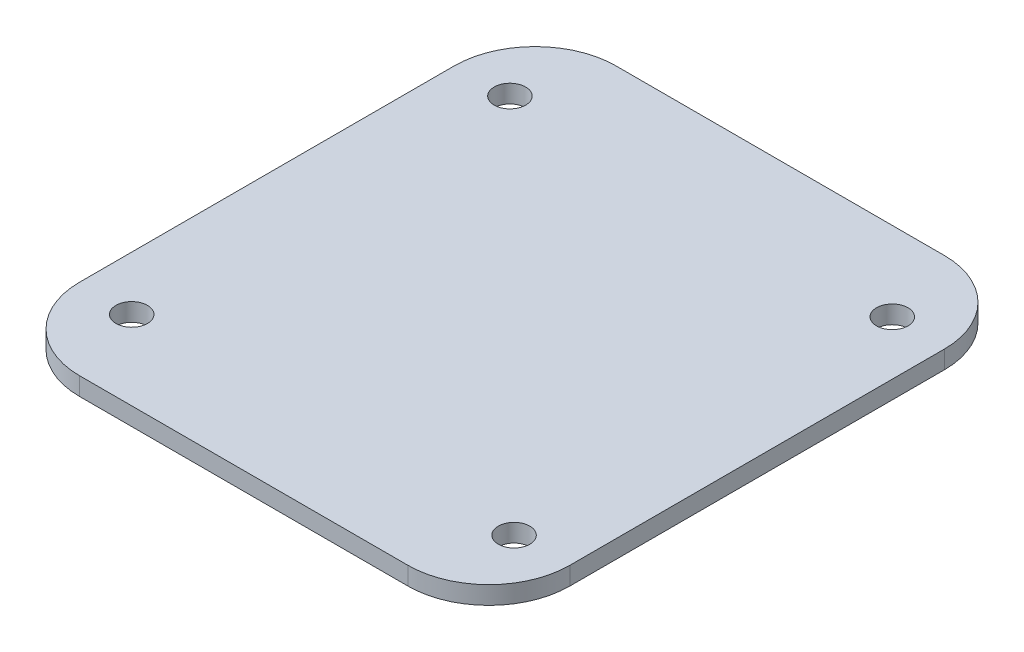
SolidWorks part; units mm, degrees
ref_plane "Front Plane" through (0, 0, 0) normal (0, 0, 1) x (1, 0, 0)
ref_plane "Top Plane" through (0, 0, 0) normal (0, 1, 0) x (1, 0, 0)
ref_plane "Right Plane" through (0, 0, 0) normal (1, 0, 0) x (0, 0, -1)
sketch "sk w14x665" plane through (0, 0, 0) normal (0, 1, 0) x (1, 0, 0)
  line L0 (-224.155, 274.828) -> (224.155, -274.828) construction
  point P1 (35.941, 0)
  line B0 (-224.155, -274.828) -> (-224.155, -160.02)
  line B1 (-224.155, -160.02) -> (-51.181, -160.02)
  line B2 (-35.941, -144.78) -> (-35.941, 144.78)
  line B3 (-51.181, 160.02) -> (-224.155, 160.02)
  line B4 (-224.155, 160.02) -> (-224.155, 274.828)
  line B5 (-224.155, 274.828) -> (224.155, 274.828)
  line B6 (224.155, 274.828) -> (224.155, 160.02)
  line B7 (224.155, 160.02) -> (51.181, 160.02)
  line B8 (35.941, 144.78) -> (35.941, -144.78)
  line B9 (51.181, -160.02) -> (224.155, -160.02)
  line B10 (224.155, -160.02) -> (224.155, -274.828)
  line B11 (224.155, -274.828) -> (-224.155, -274.828)
  line B12 (0, -346.9641) -> (0, 274.828) construction
  arc B13 (-51.181, -160.02) -> (-35.941, -144.78) centre (-51.181, -144.78) ccw
  arc B14 (-35.941, 144.78) -> (-51.181, 160.02) centre (-51.181, 144.78) ccw
  arc B15 (51.181, 160.02) -> (35.941, 144.78) centre (51.181, 144.78) ccw
  arc B16 (35.941, -144.78) -> (51.181, -160.02) centre (51.181, -144.78) ccw
sketch_block_instance "W14x665-1"
sketch_block "W14x665" parameters "D6"=15.24, "D1"=71.882, "D2"=448.31, "D3"=549.656, "D4"=114.808, "D5"=114.808, "D7"=35.941
ref_plane "midplane" through (0, 44.45, 0) normal (0, 1, 0) x (1, 0, 0)
sketch "clearance" plane through (0, 44.45, 0) normal (0, 1, 0) x (1, 0, 0)
  line L6 (-224.155, 274.828) -> (224.155, 274.828) construction
  line L7 (-224.155, 160.02) -> (-224.155, 274.828) construction
  line L8 (-51.181, 160.02) -> (-224.155, 160.02) construction
  line L9 (-35.941, -144.78) -> (-35.941, 144.78) construction
  line L10 (35.941, 144.78) -> (35.941, -144.78) construction
  line L12 (224.155, 274.828) -> (224.155, 160.02) construction
  line L13 (51.181, -160.02) -> (224.155, -160.02) construction
  line L14 (224.155, -274.828) -> (-224.155, -274.828) construction
  line L68 (-229.235, 271.5441) -> (-220.8711, 279.908)
  line L69 (-220.8711, 279.908) -> (220.8711, 279.908)
  line L70 (220.8711, 279.908) -> (229.235, 271.5441)
  line L71 (229.235, 271.5441) -> (229.235, 163.3039)
  line L72 (229.235, 163.3039) -> (220.8711, 154.94)
  line L73 (220.8711, 154.94) -> (50.0013, 154.94)
  line L74 (50.0013, 154.94) -> (41.021, 145.9597)
  line L75 (41.021, 145.9597) -> (41.021, -145.9597)
  line L76 (41.021, -145.9597) -> (50.0013, -154.94)
  line L77 (50.0013, -154.94) -> (220.8711, -154.94)
  line L78 (220.8711, -154.94) -> (229.235, -163.3039)
  line L79 (229.235, -163.3039) -> (229.235, -271.5441)
  line L80 (229.235, -271.5441) -> (220.8711, -279.908)
  line L81 (220.8711, -279.908) -> (-220.8711, -279.908)
  line L82 (-220.8711, -279.908) -> (-229.235, -271.5441)
  line L83 (-229.235, -271.5441) -> (-229.235, -163.3039)
  line L84 (-229.235, -163.3039) -> (-220.8711, -154.94)
  line L85 (-220.8711, -154.94) -> (-50.0013, -154.94)
  line L86 (-50.0013, -154.94) -> (-41.021, -145.9597)
  line L87 (-41.021, -145.9597) -> (-41.021, 145.9597)
  line L88 (-41.021, 145.9597) -> (-50.0013, 154.94)
  line L89 (-50.0013, 154.94) -> (-220.8711, 154.94)
  line L90 (-220.8711, 154.94) -> (-229.235, 163.3039)
  line L91 (-229.235, 163.3039) -> (-229.235, 271.5441)
  dimension "D3" = 1.27
  dimension "D4" = 45
  dimension "D5" = 45
  dimension "D6" = 1.27
  dimension "D7" = 5.08
  dimension "D8" = 1.27
  dimension "D9" = 5.08
  dimension "D10" = 5.08
  dimension "D11" = 5.08
  dimension "D12" = 5.08
  dimension "D13" = 1.27
  dimension "D14" = 5.08
  dimension "D15" = 1.27
  dimension "D16" = 5.08
  dimension "D17" = 12.7
  dimension "D18" = 1.27
  dimension "D19" = 5.08
  dimension "D20" = 12.7
  dimension "D21" = 12.7
  dimension "D22" = 12.7
  dimension "D23" = 1.27
  dimension "D24" = 1.27
sketch "bolt plate boundary" plane through (0, 0, 0) normal (0, 1, 0) x (1, 0, 0)
  line L7 (224.155, -274.828) -> (241.3488, -295.9087)
  line L8 (-220.8711, 279.908) -> (220.8711, 279.908) construction
  line L9 (-224.155, 274.828) -> (224.155, -274.828) construction
  line L10 (-41.021, -145.9597) -> (-41.021, 145.9597) construction
  line L11 (-224.155, 274.828) -> (-241.3488, 295.9087)
  line L12 (41.021, 145.9597) -> (41.021, -145.9597) construction
  line L15 (220.8711, -279.908) -> (-220.8711, -279.908) construction
  point P15 (0, -305.5874)
  point P16 (-66.7004, 0)
  point P17 (-308.3103, 362.8701)
  point P18 (-308.3103, 362.8701)
  point P19 (66.7004, 0)
  line B0 (-308.3103, 362.8701) -> (-350.8966, 289.1084) construction
  line B1 (-268.8989, 294.6076) -> (-229.4875, 362.8701)
  line B2 (-229.4875, 362.8701) -> (-268.8989, 431.1326)
  line B3 (-268.8989, 431.1326) -> (-347.7216, 431.1326)
  line B4 (-347.7216, 431.1326) -> (-387.133, 362.8701)
  line B5 (-387.133, 362.8701) -> (-347.7216, 294.6076)
  line B6 (-347.7216, 294.6076) -> (-268.8989, 294.6076)
  line B7 (-375.2717, 429.8316) -> (-241.3488, 295.9087) construction
  line B8 (-241.3488, 429.8316) -> (-375.2717, 295.9087) construction
  line B9 (-308.3103, 362.8701) -> (-282.9103, 362.8701) construction
  circle B10 centre (-308.3103, 362.8701) radius 44.45
  circle B11 centre (-308.3103, 362.8701) radius 68.2625 construction
  circle B12 centre (-308.3103, 362.8701) radius 85.1727
  circle B13 centre (-308.3103, 362.8701) radius 94.6977 construction
  line B14 (308.3103, -362.8701) -> (265.7239, -436.6319) construction
  line B15 (347.7216, -431.1326) -> (387.133, -362.8701)
  line B16 (387.133, -362.8701) -> (347.7216, -294.6076)
  line B17 (347.7216, -294.6076) -> (268.8989, -294.6076)
  line B18 (268.8989, -294.6076) -> (229.4875, -362.8701)
  line B19 (229.4875, -362.8701) -> (268.8989, -431.1326)
  line B20 (268.8989, -431.1326) -> (347.7216, -431.1326)
  line B21 (241.3488, -295.9087) -> (375.2717, -429.8316) construction
  line B22 (375.2717, -295.9087) -> (241.3488, -429.8316) construction
  line B23 (308.3103, -362.8701) -> (333.7103, -362.8701) construction
  circle B24 centre (308.3103, -362.8701) radius 44.45
  circle B25 centre (308.3103, -362.8701) radius 68.2625 construction
  circle B26 centre (308.3103, -362.8701) radius 85.1727
  circle B27 centre (308.3103, -362.8701) radius 94.6977 construction
  line B28 (39.4114, 468.5476) -> (-39.4114, 468.5476)
  line B29 (-78.8227, 400.2851) -> (-39.4114, 332.0226)
  line B30 (-39.4114, 332.0226) -> (39.4114, 332.0226)
  line B31 (-66.9614, 467.2466) -> (66.9614, 333.3237) construction
  line B32 (66.9614, 467.2466) -> (-66.9614, 333.3237) construction
  circle B33 centre (0, 400.2851) radius 44.45
  circle B34 centre (0, 400.2851) radius 68.2625 construction
  circle B35 centre (0, 400.2851) radius 85.1727
  circle B36 centre (0, 400.2851) radius 94.6977 construction
  line B37 (39.4114, -332.0226) -> (-39.4114, -332.0226)
  line B38 (-39.4114, -332.0226) -> (-78.8227, -400.2851)
  line B39 (-39.4114, -468.5476) -> (39.4114, -468.5476)
  line B40 (0, -400.2851) -> (25.4, -400.2851) construction
  circle B41 centre (0, -400.2851) radius 44.45
  circle B42 centre (0, -400.2851) radius 68.2625 construction
  circle B43 centre (0, -400.2851) radius 85.1727
  circle B44 centre (0, -400.2851) radius 94.6977 construction
  line B45 (-161.3981, 0) -> (-203.9845, -73.7618) construction
  line B46 (-82.5754, 0) -> (-121.9868, 68.2625)
  line B47 (-200.8095, 68.2625) -> (-240.2209, 0)
  line B48 (-240.2209, 0) -> (-200.8095, -68.2625)
  line B49 (-228.3596, 66.9614) -> (-94.4367, -66.9614) construction
  line B50 (-94.4367, 66.9614) -> (-228.3596, -66.9614) construction
  line B51 (-161.3981, 0) -> (-135.9981, 0) construction
  circle B52 centre (-161.3981, 0) radius 44.45
  circle B53 centre (-161.3981, 0) radius 68.2625 construction
  circle B54 centre (-161.3981, 0) radius 85.1727
  circle B55 centre (-161.3981, 0) radius 94.6977 construction
  line B56 (200.8095, -68.2625) -> (240.2209, 0)
  line B57 (240.2209, 0) -> (200.8095, 68.2625)
  line B58 (200.8095, 68.2625) -> (121.9868, 68.2625)
  line B59 (121.9868, 68.2625) -> (82.5754, 0)
  line B60 (82.5754, 0) -> (121.9868, -68.2625)
  line B61 (94.4367, 66.9614) -> (228.3596, -66.9614) construction
  line B62 (161.3981, 0) -> (186.7981, 0) construction
  circle B63 centre (161.3981, 0) radius 44.45
  circle B64 centre (161.3981, 0) radius 68.2625 construction
  circle B65 centre (161.3981, 0) radius 85.1727
  circle B66 centre (161.3981, 0) radius 94.6977 construction
  dimension "D1" = 27.2034
  dimension "D2" = 25.6794
  dimension "D3" = 25.6794
  dimension "D4" = 25.6794
  dimension "D5" = 25.6794
  dimension "D6" = 27.2034
sketch_block_instance "3.5in bolt-3"
sketch_block "3.5in bolt" parameters "D1"=88.9, "D2"=136.525, "D3"=6.35, "D4"=40.7227, "D5"=45, "D6"=9.525
sketch_block_instance "3.5in bolt-4"
sketch_block_instance "3.5in bolt-5"
sketch_block_instance "3.5in bolt-6"
sketch_block_instance "3.5in bolt-7"
sketch_block_instance "3.5in bolt-8"
sketch "Sketch4" plane through (0, 0, 0) normal (0, 1, 0) x (1, 0, 0)
  line L1 (-403.008, 494.9829) -> (403.008, 494.9829)
  line L2 (-403.008, 494.9829) -> (-403.008, -494.9829)
  line L3 (-403.008, -494.9829) -> (403.008, -494.9829)
  line L4 (403.008, 494.9829) -> (403.008, -494.9829)
  circle A1 centre (308.3103, -362.8701) radius 94.6977 construction
  circle A2 centre (0, 400.2851) radius 94.6977 construction
  circle A3 centre (-308.3103, 362.8701) radius 94.6977 construction
  circle A4 centre (0, -400.2851) radius 94.6977 construction
extrude "main plate" add sketch "Sketch4" along normal blind 25.4
sketch "sk bolt holes" plane through (0, 0, 0) normal (0, 1, 0) x (1, 0, 0)
  circle A0 centre (-308.3103, 362.8701) radius 46.0375
  circle A1 centre (0, 400.2851) radius 46.0375
  circle A2 centre (308.3103, 362.8701) radius 46.0375
  circle A3 centre (-308.3103, -362.8701) radius 46.0375
  circle A4 centre (0, -400.2851) radius 46.0375
  circle A5 centre (-161.3981, 0) radius 46.0375
  circle A6 centre (161.3981, 0) radius 46.0375
  circle A7 centre (308.3103, -362.8701) radius 46.0375
  circle A8 centre (-308.3103, 362.8701) radius 44.45 construction
  circle A9 centre (308.3103, -362.8701) radius 44.45 construction
  circle A10 centre (0, 400.2851) radius 44.45 construction
  circle A11 centre (0, -400.2851) radius 44.45 construction
  circle A12 centre (-161.3981, 0) radius 44.45 construction
  circle A13 centre (161.3981, 0) radius 44.45 construction
  dimension "D1" = 92.075
  dimension "D2" = 92.075
  dimension "D3" = 92.075
  dimension "D4" = 92.075
  dimension "D5" = 92.075
  dimension "D6" = 92.075
  dimension "3.56250000in" = 92.075
  dimension "D7" = 92.075
extrude "Cut-Extrude2" [suppressed] cut sketch "sk bolt holes" along normal blind 88.9
fillet "Fillet1" radius 139.7 4 edges at (-403.008, 12.7, -494.9829) (403.008, 12.7, -494.9829) (403.008, 12.7, 494.9829) (-403.008, 12.7, 494.9829)
sketch "Sketch5" [suppressed] plane through (0, 25.4, 0) normal (0, 1, 0) x (1, 0, 0)
  line L1 (-517.2218, 542.3296) -> (487.0923, 542.3296)
  line L2 (-517.2218, 542.3296) -> (-517.2218, -547.3512)
  line L3 (-517.2218, -547.3512) -> (487.0923, -547.3512)
  line L4 (487.0923, 542.3296) -> (487.0923, -547.3512)
extrude "Cut-Extrude3" [suppressed] cut sketch "Sketch5" against normal blind 12.7
sketch "Sketch6" plane through (0, 0, 0) normal (0, 1, 0) x (1, 0, 0)
  point P0 (0, 494.9829)
  point P1 (-403.008, 0)
  line B0 (403.008, 368.6679) -> (403.008, -368.6679)
  line B1 (314.108, -457.5679) -> (108.1676, -457.5679)
  line B2 (63.2663, -476.1666) -> (63.0487, -476.3842)
  line B3 (18.1474, -494.9829) -> (-18.1474, -494.9829)
  line B4 (-63.0487, -476.3842) -> (-63.2663, -476.1666)
  line B5 (-108.1676, -457.5679) -> (-314.108, -457.5679)
  line B6 (-403.008, -368.6679) -> (-403.008, 368.6679)
  line B7 (-314.108, 457.5679) -> (-108.1676, 457.5679)
  line B8 (-63.2663, 476.1666) -> (-63.0487, 476.3842)
  line B9 (-18.1474, 494.9829) -> (18.1474, 494.9829)
  line B10 (63.0487, 476.3842) -> (63.2663, 476.1666)
  line B11 (108.1676, 457.5679) -> (314.108, 457.5679)
  line B12 (-573.1445, 780.0685) -> (706.3295, 780.0685)
  line B13 (-573.1445, 780.0685) -> (-573.1445, -757.0177)
  line B14 (-573.1445, -757.0177) -> (706.3295, -757.0177)
  line B15 (706.3295, 780.0685) -> (706.3295, -757.0177)
  arc B16 (108.1676, -457.5679) -> (63.2663, -476.1666) centre (108.1676, -521.0679) ccw
  arc B17 (63.0487, -476.3842) -> (18.1474, -494.9829) centre (18.1474, -431.4829) cw
  arc B18 (-18.1474, -494.9829) -> (-63.0487, -476.3842) centre (-18.1474, -431.4829) cw
  arc B19 (-63.2663, -476.1666) -> (-108.1676, -457.5679) centre (-108.1676, -521.0679) ccw
  arc B20 (403.008, -368.6679) -> (314.108, -457.5679) centre (314.108, -368.6679) cw
  arc B21 (-314.108, -457.5679) -> (-403.008, -368.6679) centre (-314.108, -368.6679) cw
  arc B22 (403.008, 368.6679) -> (314.108, 457.5679) centre (314.108, 368.6679) ccw
  arc B23 (-403.008, 368.6679) -> (-314.108, 457.5679) centre (-314.108, 368.6679) cw
  arc B24 (63.2663, 476.1666) -> (108.1676, 457.5679) centre (108.1676, 521.0679) ccw
  arc B25 (18.1474, 494.9829) -> (63.0487, 476.3842) centre (18.1474, 431.4829) cw
  arc B26 (-63.0487, 476.3842) -> (-18.1474, 494.9829) centre (-18.1474, 431.4829) cw
  arc B27 (-108.1676, 457.5679) -> (-63.2663, 476.1666) centre (-108.1676, 521.0679) ccw
sketch_block_instance "Block1-1"
sketch_block "Block1"
extrude "Edge cut" cut sketch "Sketch6" along normal blind 25.4
sketch "Sketch7" plane through (0, 0, 0) normal (0, 1, 0) x (1, 0, 0)
  line L13 (-506.5225, 548.6406) -> (494.7508, 548.6406)
  line L14 (-506.5225, 548.6406) -> (-506.5225, -578.858)
  line L15 (-506.5225, -578.858) -> (494.7508, -578.858)
  line L16 (494.7508, 548.6406) -> (494.7508, -578.858)
  line L24 (-314.108, -444.8679) -> (-108.1676, -444.8679)
  line L25 (-54.286, -467.1863) -> (-54.0685, -467.4039)
  line L26 (-18.1474, -482.2829) -> (18.1474, -482.2829)
  line L27 (54.0685, -467.4039) -> (54.286, -467.1863)
  line L28 (108.1676, -444.8679) -> (314.108, -444.8679)
  line L29 (390.308, -355.2829) -> (390.308, 355.2829)
  line L30 (-390.308, 355.2829) -> (-390.308, -355.2829)
  line L31 (314.108, 444.8679) -> (108.1676, 444.8679)
  line L32 (54.286, 467.1863) -> (54.0685, 467.4039)
  line L33 (18.1474, 482.2829) -> (-18.1474, 482.2829)
  line L34 (-54.0685, 467.4039) -> (-54.286, 467.1863)
  line L35 (-108.1676, 444.8679) -> (-314.108, 444.8679)
  line L36 (-314.108, -444.8679) -> (-108.1676, -444.8679)
  line L37 (-54.286, -467.1863) -> (-54.0685, -467.4039)
  line L38 (-18.1474, -482.2829) -> (18.1474, -482.2829)
  line L39 (54.0685, -467.4039) -> (54.286, -467.1863)
  line L40 (108.1676, -444.8679) -> (314.108, -444.8679)
  line L41 (390.308, -355.2829) -> (390.308, 355.2829)
  line L42 (-390.308, 355.2829) -> (-390.308, -355.2829)
  line L43 (314.108, 444.8679) -> (108.1676, 444.8679)
  line L44 (54.286, 467.1863) -> (54.0685, 467.4039)
  line L45 (18.1474, 482.2829) -> (-18.1474, 482.2829)
  line L46 (-54.0685, 467.4039) -> (-54.286, 467.1863)
  line L47 (-108.1676, 444.8679) -> (-314.108, 444.8679)
  arc A32 (314.108, -444.8679) -> (377.3411, -411.1887) centre (314.108, -368.6679) ccw
  arc A33 (-377.3411, -411.1887) -> (-314.108, -444.8679) centre (-314.108, -368.6679) ccw
  arc A34 (-54.286, -467.1863) -> (-108.1676, -444.8679) centre (-108.1676, -521.0679) ccw
  arc A35 (-54.0685, -467.4039) -> (-18.1474, -482.2829) centre (-18.1474, -431.4829) ccw
  arc A36 (18.1474, -482.2829) -> (54.0685, -467.4039) centre (18.1474, -431.4829) ccw
  arc A37 (108.1676, -444.8679) -> (54.286, -467.1863) centre (108.1676, -521.0679) ccw
  arc A38 (390.308, 355.2829) -> (377.3411, 411.1887) centre (263.308, 355.2829) ccw
  arc A39 (377.3411, -411.1887) -> (390.308, -355.2829) centre (263.308, -355.2829) ccw
  arc A40 (-390.308, -355.2829) -> (-377.3411, -411.1887) centre (-263.308, -355.2829) ccw
  arc A41 (-377.3411, 411.1887) -> (-390.308, 355.2829) centre (-263.308, 355.2829) ccw
  arc A42 (-314.108, 444.8679) -> (-377.3411, 411.1887) centre (-314.108, 368.6679) ccw
  arc A43 (377.3411, 411.1887) -> (314.108, 444.8679) centre (314.108, 368.6679) ccw
  arc A44 (54.286, 467.1863) -> (108.1676, 444.8679) centre (108.1676, 521.0679) ccw
  arc A45 (54.0685, 467.4039) -> (18.1474, 482.2829) centre (18.1474, 431.4829) ccw
  arc A46 (-18.1474, 482.2829) -> (-54.0685, 467.4039) centre (-18.1474, 431.4829) ccw
  arc A47 (-108.1676, 444.8679) -> (-54.286, 467.1863) centre (-108.1676, 521.0679) ccw
  arc A48 (314.108, -444.8679) -> (377.3411, -411.1887) centre (314.108, -368.6679) ccw
  arc A49 (-377.3411, -411.1887) -> (-314.108, -444.8679) centre (-314.108, -368.6679) ccw
  arc A50 (-54.286, -467.1863) -> (-108.1676, -444.8679) centre (-108.1676, -521.0679) ccw
  arc A51 (-54.0685, -467.4039) -> (-18.1474, -482.2829) centre (-18.1474, -431.4829) ccw
  arc A52 (18.1474, -482.2829) -> (54.0685, -467.4039) centre (18.1474, -431.4829) ccw
  arc A53 (108.1676, -444.8679) -> (54.286, -467.1863) centre (108.1676, -521.0679) ccw
  arc A54 (390.308, 355.2829) -> (377.3411, 411.1887) centre (263.308, 355.2829) ccw
  arc A55 (377.3411, -411.1887) -> (390.308, -355.2829) centre (263.308, -355.2829) ccw
  arc A56 (-390.308, -355.2829) -> (-377.3411, -411.1887) centre (-263.308, -355.2829) ccw
  arc A57 (-377.3411, 411.1887) -> (-390.308, 355.2829) centre (-263.308, 355.2829) ccw
  arc A58 (-314.108, 444.8679) -> (-377.3411, 411.1887) centre (-314.108, 368.6679) ccw
  arc A59 (377.3411, 411.1887) -> (314.108, 444.8679) centre (314.108, 368.6679) ccw
  arc A60 (54.286, 467.1863) -> (108.1676, 444.8679) centre (108.1676, 521.0679) ccw
  arc A61 (54.0685, 467.4039) -> (18.1474, 482.2829) centre (18.1474, 431.4829) ccw
  arc A62 (-18.1474, 482.2829) -> (-54.0685, 467.4039) centre (-18.1474, 431.4829) ccw
  arc A63 (-108.1676, 444.8679) -> (-54.286, 467.1863) centre (-108.1676, 521.0679) ccw
  dimension "D1" = 12.7
extrude "Cut-Extrude4" cut sketch "Sketch7" along normal blind 25.4
sketch "Sketch8" plane through (0, 0, 0) normal (0, 1, 0) x (1, 0, 0)
  circle A0 centre (-308.3103, 362.8701) radius 46.0375 construction
  circle A1 centre (0, 400.2851) radius 46.0375 construction
  circle A2 centre (308.3103, 362.8701) radius 46.0375 construction
  circle A3 centre (-161.3981, 0) radius 46.0375 construction
  circle A4 centre (161.3981, 0) radius 46.0375 construction
  circle A5 centre (-308.3103, -362.8701) radius 46.0375 construction
  circle A6 centre (0, -400.2851) radius 46.0375 construction
  circle A7 centre (308.3103, -362.8701) radius 46.0375 construction
sketch_block_instance "Block4-1"
sketch_block "Block4" parameters "D1"=71.4375, "D2"=93.98
sketch_block_instance "Block4-2"
sketch_block_instance "Block4-3"
sketch_block_instance "Block4-4"
sketch_block_instance "Block4-5"
sketch_block_instance "Block4-6"
sketch_block_instance "Block4-7"
sketch_block_instance "Block4-8"
extrude "Boss-Extrude1" [suppressed] add sketch "Sketch8" along normal blind 25.4
sketch "Sketch9" [suppressed] plane through (0, 0, 0) normal (0, 1, 0) x (1, 0, 0)
  line L13 (-545.4331, 590.5033) -> (520.9998, 590.5033)
  line L14 (-545.4331, 590.5033) -> (-545.4331, -615.1185)
  line L15 (-545.4331, -615.1185) -> (520.9998, -615.1185)
  line L16 (520.9998, 590.5033) -> (520.9998, -615.1185)
  line L24 (-314.108, -444.8679) -> (-108.1676, -444.8679)
  line L25 (-54.286, -467.1863) -> (-54.0685, -467.4039)
  line L26 (-18.1474, -482.2829) -> (18.1474, -482.2829)
  line L27 (54.0685, -467.4039) -> (54.286, -467.1863)
  line L28 (108.1676, -444.8679) -> (314.108, -444.8679)
  line L29 (390.308, -355.2829) -> (390.308, 355.2829)
  line L30 (-390.308, 355.2829) -> (-390.308, -355.2829)
  line L31 (314.108, 444.8679) -> (108.1676, 444.8679)
  line L32 (54.286, 467.1863) -> (54.0685, 467.4039)
  line L33 (18.1474, 482.2829) -> (-18.1474, 482.2829)
  line L34 (-54.0685, 467.4039) -> (-54.286, 467.1863)
  line L35 (-108.1676, 444.8679) -> (-314.108, 444.8679)
  line L36 (-314.108, -444.8679) -> (-108.1676, -444.8679)
  line L37 (-54.286, -467.1863) -> (-54.0685, -467.4039)
  line L38 (-18.1474, -482.2829) -> (18.1474, -482.2829)
  line L39 (54.0685, -467.4039) -> (54.286, -467.1863)
  line L40 (108.1676, -444.8679) -> (314.108, -444.8679)
  line L41 (390.308, -355.2829) -> (390.308, 355.2829)
  line L42 (-390.308, 355.2829) -> (-390.308, -355.2829)
  line L43 (314.108, 444.8679) -> (108.1676, 444.8679)
  line L44 (54.286, 467.1863) -> (54.0685, 467.4039)
  line L45 (18.1474, 482.2829) -> (-18.1474, 482.2829)
  line L46 (-54.0685, 467.4039) -> (-54.286, 467.1863)
  line L47 (-108.1676, 444.8679) -> (-314.108, 444.8679)
  arc A32 (-377.3411, -411.1887) -> (-314.108, -444.8679) centre (-314.108, -368.6679) ccw
  arc A33 (-54.286, -467.1863) -> (-108.1676, -444.8679) centre (-108.1676, -521.0679) ccw
  arc A34 (-54.0685, -467.4039) -> (-18.1474, -482.2829) centre (-18.1474, -431.4829) ccw
  arc A35 (18.1474, -482.2829) -> (54.0685, -467.4039) centre (18.1474, -431.4829) ccw
  arc A36 (108.1676, -444.8679) -> (54.286, -467.1863) centre (108.1676, -521.0679) ccw
  arc A37 (314.108, -444.8679) -> (377.3411, -411.1887) centre (314.108, -368.6679) ccw
  arc A38 (390.308, 355.2829) -> (377.3411, 411.1887) centre (263.308, 355.2829) ccw
  arc A39 (377.3411, -411.1887) -> (390.308, -355.2829) centre (263.308, -355.2829) ccw
  arc A40 (-390.308, -355.2829) -> (-377.3411, -411.1887) centre (-263.308, -355.2829) ccw
  arc A41 (-377.3411, 411.1887) -> (-390.308, 355.2829) centre (-263.308, 355.2829) ccw
  arc A42 (377.3411, 411.1887) -> (314.108, 444.8679) centre (314.108, 368.6679) ccw
  arc A43 (54.286, 467.1863) -> (108.1676, 444.8679) centre (108.1676, 521.0679) ccw
  arc A44 (54.0685, 467.4039) -> (18.1474, 482.2829) centre (18.1474, 431.4829) ccw
  arc A45 (-18.1474, 482.2829) -> (-54.0685, 467.4039) centre (-18.1474, 431.4829) ccw
  arc A46 (-108.1676, 444.8679) -> (-54.286, 467.1863) centre (-108.1676, 521.0679) ccw
  arc A47 (-314.108, 444.8679) -> (-377.3411, 411.1887) centre (-314.108, 368.6679) ccw
  arc A48 (-377.3411, -411.1887) -> (-314.108, -444.8679) centre (-314.108, -368.6679) ccw
  arc A49 (-54.286, -467.1863) -> (-108.1676, -444.8679) centre (-108.1676, -521.0679) ccw
  arc A50 (-54.0685, -467.4039) -> (-18.1474, -482.2829) centre (-18.1474, -431.4829) ccw
  arc A51 (18.1474, -482.2829) -> (54.0685, -467.4039) centre (18.1474, -431.4829) ccw
  arc A52 (108.1676, -444.8679) -> (54.286, -467.1863) centre (108.1676, -521.0679) ccw
  arc A53 (314.108, -444.8679) -> (377.3411, -411.1887) centre (314.108, -368.6679) ccw
  arc A54 (390.308, 355.2829) -> (377.3411, 411.1887) centre (263.308, 355.2829) ccw
  arc A55 (377.3411, -411.1887) -> (390.308, -355.2829) centre (263.308, -355.2829) ccw
  arc A56 (-390.308, -355.2829) -> (-377.3411, -411.1887) centre (-263.308, -355.2829) ccw
  arc A57 (-377.3411, 411.1887) -> (-390.308, 355.2829) centre (-263.308, 355.2829) ccw
  arc A58 (377.3411, 411.1887) -> (314.108, 444.8679) centre (314.108, 368.6679) ccw
  arc A59 (54.286, 467.1863) -> (108.1676, 444.8679) centre (108.1676, 521.0679) ccw
  arc A60 (54.0685, 467.4039) -> (18.1474, 482.2829) centre (18.1474, 431.4829) ccw
  arc A61 (-18.1474, 482.2829) -> (-54.0685, 467.4039) centre (-18.1474, 431.4829) ccw
  arc A62 (-108.1676, 444.8679) -> (-54.286, 467.1863) centre (-108.1676, 521.0679) ccw
  arc A63 (-314.108, 444.8679) -> (-377.3411, 411.1887) centre (-314.108, 368.6679) ccw
  dimension "D1" = 12.7
extrude "Cut-Extrude5" [suppressed] cut sketch "Sketch9" along normal blind 25.4
sketch "Sketch10" plane through (0, 0, 0) normal (0, 1, 0) x (1, 0, 0)
  circle A0 centre (-308.3103, 362.8701) radius 46.0375 construction
  circle A1 centre (0, 400.2851) radius 46.0375 construction
  circle A2 centre (308.3103, 362.8701) radius 46.0375 construction
  circle A3 centre (-161.3981, 0) radius 46.0375 construction
  circle A4 centre (161.3981, 0) radius 46.0375 construction
  circle A5 centre (-308.3103, -362.8701) radius 46.0375 construction
  circle A6 centre (0, -400.2851) radius 46.0375 construction
  circle A7 centre (308.3103, -362.8701) radius 46.0375 construction
sketch_block_instance "Block4-9"
sketch_block_instance "Block4-10"
sketch_block_instance "Block4-11"
sketch_block_instance "Block4-12"
sketch_block_instance "Block4-13"
sketch_block_instance "Block4-14"
sketch_block_instance "Block4-15"
sketch_block_instance "Block4-16"
extrude "Boss-Extrude2" [suppressed] add sketch "Sketch10" along normal blind 12.7
sketch "Sketch11" plane through (0, 0, 0) normal (0, 1, 0) x (1, 0, 0)
  line L0 (-284.2097, 311.9592) -> (284.2097, -311.9592) construction
  line L1 (284.2097, -311.9592) -> (-284.2097, -311.9592) construction
  point P2 (0, 0)
  circle B0 centre (-284.2097, 311.9592) radius 32.5438
  circle B1 centre (0, 347.5192) radius 32.5437
  circle B2 centre (284.2097, 311.9592) radius 32.5438
  circle B3 centre (-161.544, 0) radius 32.5437
  circle B4 centre (161.544, 0) radius 32.5438
  circle B5 centre (284.2097, -311.9592) radius 32.5437
  circle B6 centre (0, -347.5192) radius 32.5437
  circle B7 centre (-284.2097, -311.9592) radius 32.5438
sketch_block_instance "Block5-1"
sketch_block "Block5" parameters "D1"=65.0875, "D2"=65.0875, "D3"=65.0875, "D4"=65.0875, "D5"=65.0875, "D6"=65.0875, "D7"=65.0875, "D8"=65.0875
sketch "Sketch12" plane through (0, 0, 0) normal (0, 1, 0) x (1, 0, 0)
  line L1 (-246.1097, 423.7192) -> (246.1097, 423.7192)
  line L2 (-360.4097, 309.4192) -> (-360.4097, -309.4192)
  line L3 (-246.1097, -423.7192) -> (246.1097, -423.7192)
  line L4 (360.4097, 309.4192) -> (360.4097, -309.4192)
  line L5 (-687.2395, 639.3842) -> (677.7027, 639.3842)
  line L6 (-687.2395, 639.3842) -> (-687.2395, -673.7844)
  line L7 (-687.2395, -673.7844) -> (677.7027, -673.7844)
  line L8 (677.7027, 639.3842) -> (677.7027, -673.7844)
  arc A0 (-360.4097, -309.4192) -> (-246.1097, -423.7192) centre (-246.1097, -309.4192) ccw
  arc A1 (246.1097, -423.7192) -> (360.4097, -309.4192) centre (246.1097, -309.4192) ccw
  arc A2 (246.1097, 423.7192) -> (360.4097, 309.4192) centre (246.1097, 309.4192) cw
  arc A3 (-246.1097, 423.7192) -> (-360.4097, 309.4192) centre (-246.1097, 309.4192) ccw
  point P12 (-360.4097, 0)
  point P13 (0, 423.7192)
  dimension "D1" = 114.3
  dimension "D2" = 720.8194
  dimension "D3" = 847.4384
extrude "Cut-Extrude6" [suppressed] cut sketch "Sketch11" along normal through all
extrude "Cut-Extrude7" [suppressed] cut sketch "Sketch12" along normal through all
sketch "Sketch13" plane through (0, 0, 0) normal (0, 1, 0) x (1, 0, 0)
  line L0 (-279.6377, 297.9892) -> (279.6377, -297.9892) construction
  line L1 (279.6377, -297.9892) -> (-279.6377, -297.9892) construction
  point P2 (0, 0)
  circle B0 centre (-279.6377, 297.9892) radius 29.3687
  circle B1 centre (0, 333.5492) radius 29.3688
  circle B2 centre (279.6377, 297.9892) radius 29.3687
  circle B3 centre (-161.544, 0) radius 29.3687
  circle B4 centre (161.544, 0) radius 29.3688
  circle B5 centre (279.6377, -297.9892) radius 29.3687
  circle B6 centre (0, -333.5492) radius 29.3688
  circle B7 centre (-279.6377, -297.9892) radius 29.3687
sketch_block_instance "Block6-1"
sketch_block "Block6"
extrude "Cut-Extrude8" [suppressed] cut sketch "Sketch13" along normal through all
sketch "Sketch14" plane through (0, 0, 0) normal (0, 1, 0) x (1, 0, 0)
  line L8 (-241.5377, 295.4492) -> (241.5377, -295.4492) construction
  line L9 (-241.5377, 409.7492) -> (241.5377, 409.7492)
  line L10 (-444.2338, 509.6702) -> (470.4106, 509.6702)
  line L11 (-444.2338, 509.6702) -> (-444.2338, -580.946)
  line L12 (-444.2338, -580.946) -> (470.4106, -580.946)
  line L13 (470.4106, 509.6702) -> (470.4106, -580.946)
  line L14 (-241.5377, -409.7492) -> (241.5377, -409.7492)
  line L15 (-355.8377, 295.4492) -> (-355.8377, -295.4492)
  line L16 (355.8377, 295.4492) -> (355.8377, -295.4492)
  arc A0 (-241.5377, -409.7492) -> (-355.8377, -295.4492) centre (-241.5377, -295.4492) cw
  arc A1 (241.5377, -409.7492) -> (355.8377, -295.4492) centre (241.5377, -295.4492) ccw
  arc A2 (241.5377, 409.7492) -> (355.8377, 295.4492) centre (241.5377, 295.4492) cw
  arc A3 (-355.8377, 295.4492) -> (-241.5377, 409.7492) centre (-241.5377, 295.4492) cw
  point P2 (0, 0)
  dimension "D1" = 114.3
extrude "Cut-Extrude9" [suppressed] cut sketch "Sketch14" along normal through all
sketch "Sketch15" plane through (0, 0, 0) normal (0, 1, 0) x (1, 0, 0)
  circle B0 centre (-275.0022, 283.0032) radius 23.0187
  circle B1 centre (0, 318.5632) radius 23.0187
  circle B2 centre (275.0022, 283.0032) radius 23.0187
  circle B3 centre (-161.544, 0) radius 23.0187
  circle B4 centre (161.544, 0) radius 23.0188
  circle B5 centre (275.0022, -283.0032) radius 23.0187
  circle B6 centre (0, -318.5632) radius 23.0187
  circle B7 centre (-275.0022, -283.0032) radius 23.0187
  line B8 (275.0022, -283.0032) -> (-275.0022, -283.0032) construction
sketch_block_instance "Block8-1"
sketch_block "Block8" parameters "D1"=46.0375, "D2"=46.0375, "D3"=46.0375, "D4"=46.0375, "D5"=46.0375, "D6"=46.0375, "D7"=46.0375, "D8"=46.0375
extrude "Cut-Extrude10" [suppressed] cut sketch "Sketch15" along normal through all
sketch "Sketch16" plane through (0, 0, 0) normal (0, 1, 0) x (1, 0, 0)
  line B0 (-236.9022, 394.7632) -> (236.9022, 394.7632)
  line B1 (-236.9022, -394.7632) -> (236.9022, -394.7632)
  line B2 (-351.2022, 280.4632) -> (-351.2022, -280.4632)
  line B3 (351.2022, 280.4632) -> (351.2022, -280.4632)
  line B4 (-611.5624, 602.8787) -> (624.0589, 602.8787)
  line B5 (-611.5624, 602.8787) -> (-611.5624, -644.1484)
  line B6 (-611.5624, -644.1484) -> (624.0589, -644.1484)
  line B7 (624.0589, 602.8787) -> (624.0589, -644.1484)
  line B8 (-236.9022, 280.4632) -> (236.9022, -280.4632) construction
  arc B9 (-236.9022, -394.7632) -> (-351.2022, -280.4632) centre (-236.9022, -280.4632) cw
  arc B10 (236.9022, -394.7632) -> (351.2022, -280.4632) centre (236.9022, -280.4632) ccw
  arc B11 (236.9022, 394.7632) -> (351.2022, 280.4632) centre (236.9022, 280.4632) cw
  arc B12 (-351.2022, 280.4632) -> (-236.9022, 394.7632) centre (-236.9022, 280.4632) cw
sketch_block_instance "Block9-1"
sketch_block "Block9"
extrude "Cut-Extrude11" [suppressed] cut sketch "Sketch16" along normal through all
sketch "Sketch17" plane through (0, 0, 0) normal (0, 1, 0) x (1, 0, 0)
  line B0 (-269.9222, 267.0012) -> (269.9222, -267.0012) construction
  line B1 (269.9222, -267.0012) -> (-269.9222, -267.0012) construction
  circle B2 centre (-269.9222, 267.0012) radius 26.1937
  circle B3 centre (0, 302.5612) radius 26.1937 construction
  circle B4 centre (269.9222, 267.0012) radius 26.1938
  circle B5 centre (-161.544, 0) radius 26.1938 construction
  circle B6 centre (161.544, 0) radius 26.1937 construction
  circle B7 centre (269.9222, -267.0012) radius 26.1937
  circle B8 centre (0, -302.5612) radius 26.1938 construction
  circle B9 centre (-269.9222, -267.0012) radius 26.1938
sketch_block_instance "Block13-1"
sketch_block "Block13" parameters "D1"=52.3875, "D2"=52.3875, "D3"=52.3875, "D4"=52.3875, "D5"=52.3875, "D6"=52.3875, "D7"=52.3875, "D8"=52.3875
sketch "Sketch18" plane through (0, 0, 0) normal (0, 1, 0) x (1, 0, 0)
  line B0 (-231.8222, 378.7612) -> (231.8222, 378.7612)
  line B1 (-231.8222, -378.7612) -> (231.8222, -378.7612)
  line B2 (-346.1222, 264.4612) -> (-346.1222, -264.4612)
  line B3 (346.1222, 264.4612) -> (346.1222, -264.4612)
  line B4 (-611.5624, 602.8787) -> (624.0589, 602.8787)
  line B5 (-611.5624, 602.8787) -> (-611.5624, -644.1484)
  line B6 (-611.5624, -644.1484) -> (624.0589, -644.1484)
  line B7 (624.0589, 602.8787) -> (624.0589, -644.1484)
  line B8 (-231.8222, 264.4612) -> (231.8222, -264.4612) construction
  arc B9 (-231.8222, -378.7612) -> (-346.1222, -264.4612) centre (-231.8222, -264.4612) cw
  arc B10 (231.8222, -378.7612) -> (346.1222, -264.4612) centre (231.8222, -264.4612) ccw
  arc B11 (231.8222, 378.7612) -> (346.1222, 264.4612) centre (231.8222, 264.4612) cw
  arc B12 (-346.1222, 264.4612) -> (-231.8222, 378.7612) centre (-231.8222, 264.4612) cw
sketch_block_instance "Block14-1"
sketch_block "Block14"
extrude "Cut-Extrude12" cut sketch "Sketch17" along normal through all
extrude "Cut-Extrude13" cut sketch "Sketch18" along normal through all
sketch "Sketch19" plane through (0, 0, 0) normal (0, 1, 0) x (1, 0, 0)
  circle A0 centre (-269.9222, 267.0012) radius 26.1937 construction
  circle A1 centre (-269.9222, -267.0012) radius 26.1938 construction
  circle A2 centre (269.9222, -267.0012) radius 26.1938 construction
  circle A3 centre (269.9222, 267.0012) radius 26.1938 construction
  circle B0 centre (-269.9222, -267.0012) radius 22.225
  circle B1 centre (-269.9222, -267.0012) radius 31.75
  circle B2 centre (-269.9222, 267.0012) radius 22.225
  circle B3 centre (-269.9222, 267.0012) radius 31.75
  circle B4 centre (269.9222, 267.0012) radius 22.225
  circle B5 centre (269.9222, 267.0012) radius 31.75
  circle B6 centre (269.9222, -267.0012) radius 22.225
  circle B7 centre (269.9222, -267.0012) radius 31.75
sketch_block_instance "Block15-1"
sketch_block "Block15" parameters "D1"=44.45, "D2"=63.5
sketch_block_instance "Block15-2"
sketch_block_instance "Block15-3"
sketch_block_instance "Block15-4"
extrude "Boss-Extrude3" add sketch "Sketch19" along normal up to surface (25.4 mm away)
sketch "Sketch20" plane through (0, 0, 0) normal (0, 1, 0) x (1, 0, 0)
  circle A0 centre (-269.9222, -267.0012) radius 26.1938 construction
  circle A1 centre (-269.9222, 267.0012) radius 26.1937 construction
  circle A2 centre (269.9222, 267.0012) radius 26.1938 construction
  circle A3 centre (269.9222, -267.0012) radius 26.1938 construction
  circle B0 centre (-269.9222, 267.0012) radius 22.225
  circle B1 centre (-269.9222, 267.0012) radius 31.75
  circle B2 centre (-269.9222, -267.0012) radius 22.225
  circle B3 centre (-269.9222, -267.0012) radius 31.75
  circle B4 centre (269.9222, -267.0012) radius 22.225
  circle B5 centre (269.9222, -267.0012) radius 31.75
  circle B6 centre (269.9222, 267.0012) radius 22.225
  circle B7 centre (269.9222, 267.0012) radius 31.75
sketch_block_instance "Block15-5"
sketch_block_instance "Block15-6"
sketch_block_instance "Block15-7"
sketch_block_instance "Block15-8"
extrude "Boss-Extrude4" [suppressed] add sketch "Sketch20" along normal up to surface (12.7 mm away)
